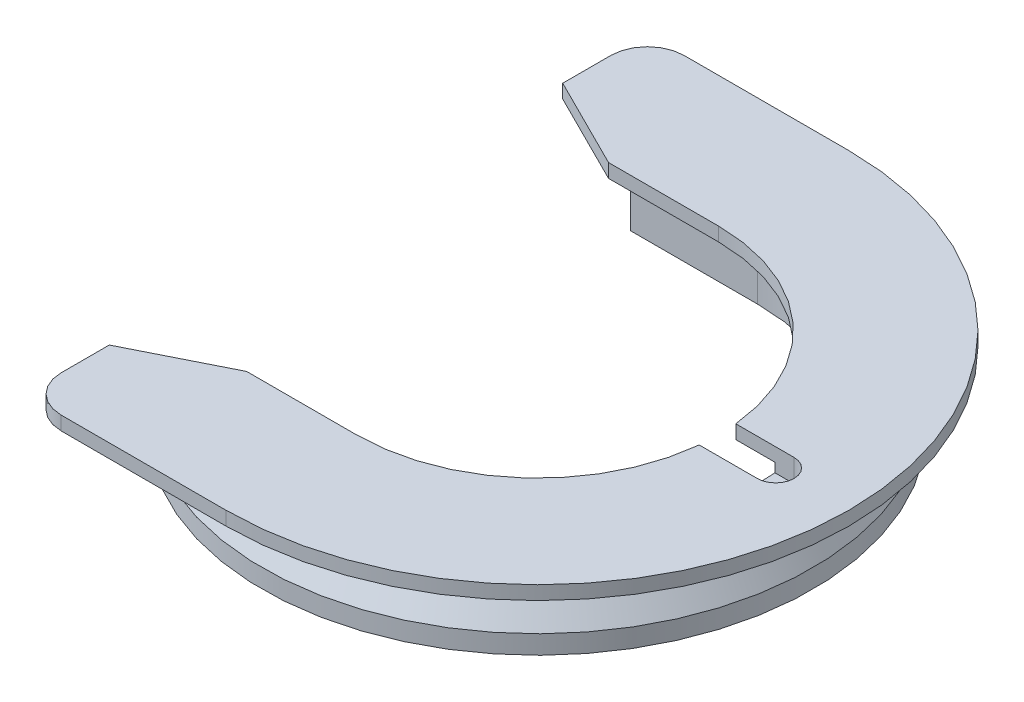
SolidWorks part; units mm, degrees
ref_plane "Front Plane" through (0, 0, 0) normal (0, 0, 1) x (1, 0, 0)
ref_plane "Top Plane" through (0, 0, 0) normal (0, 1, 0) x (1, 0, 0)
ref_plane "Right Plane" through (0, 0, 0) normal (1, 0, 0) x (0, 0, -1)
sketch "Sketch1" plane through (0, 0, 0) normal (0, 1, 0) x (1, 0, 0)
  line L0 (0, 34) -> (-22, 34)
  line L1 (-22, 34) -> (-22, -34)
  line L2 (-22, -34) -> (0, -34)
  line L3 (0, 34) -> (0, 0) construction
  line L4 (0, 0) -> (0, -34) construction
  arc A0 (0, 34) -> (0, -34) centre (0, 0) cw
  dimension "D1" = 34
  dimension "D2" = 22
extrude "Boss-Extrude1" add sketch "Sketch1" along normal blind 1.5
sketch "Sketch2" plane through (0, 1.5, 0) normal (0, 1, 0) x (1, 0, 0)
  line L0 (0, 19.75) -> (-22, 19.75)
  line L1 (-22, 34) -> (-22, -34) construction
  line L2 (-22, 19.75) -> (-22, -19.75)
  line L3 (-22, -19.75) -> (0, -19.75)
  line L4 (0, 19.75) -> (0, 0) construction
  line L5 (0, 0) -> (0, -19.75) construction
  arc A0 (0, 19.75) -> (0, -19.75) centre (0, 0) cw
  dimension "D1" = 19.75
extrude "Cut-Extrude1" cut sketch "Sketch2" against normal through all
sketch "Sketch3" plane through (0, 0, 0) normal (0, -1, 0) x (-1, 0, 0)
  line L0 (0, -24) -> (0, 0) construction
  line L1 (0, 0) -> (0, 24) construction
  line L2 (0, -24) -> (13.8564, -24)
  line L3 (0, 0) -> (10.3006, -28.3005) construction
  line L4 (13.8564, -24) -> (15, -25.9808)
  line L5 (0, 0) -> (-37.1009, 0) construction
  line L6 (0, 24) -> (13.8564, 24)
  line L7 (13.8564, 24) -> (15, 25.9808)
  line L8 (0, 0) -> (11.6618, 32.0405) construction
  arc A0 (0, -24) -> (0, 24) centre (0, 0) cw
  arc A2 (15, -25.9808) -> (15, 25.9808) centre (0, 0) cw
  dimension "D1" = 24
  dimension "D2" = 30
  dimension "D3" = 110
  dimension "D4" = 120
  dimension "D5" = 120
  dimension "D6" = 110
extrude "Boss-Extrude2" add sketch "Sketch3" along normal blind 8
sketch "Sketch7" plane through (0, 0, 0) normal (-0.866, 0, -0.5) x (-0.5, 0, 0.866)
  line L0 (30, -2.5) -> (28, -2.5)
  line L1 (30, -8) -> (30, 0) construction
  line L2 (28, -2.5) -> (30, -5.9641)
  line L3 (30, -5.9641) -> (30, -2.5)
  line L4 (30, 0) -> (27.7128, 0) construction
  dimension "D1" = 30
  dimension "D2" = 2
  dimension "D3" = 2.5
revolve "Cut-Revolve1" cut sketch "Sketch7" about axis through (0, -8, 0) along (0, 1, 0)
fillet "Fillet2" [suppressed] radius 10
fillet "Fillet3" [suppressed] radius 5
hole_wizard "M3x0.5 Tapped Hole1" positions "Sketch10" profile "Sketch9" tap size "M3x0.5" standard "ANSI Metric"
sketch "Sketch10" plane through (0, 0, 0) normal (0, 0, 1) x (1, 0, 0)
  line L0 (0, -8) -> (0, 0) construction
  line L1 (-15, 0) -> (30, 0) construction
  point P0 (-4, -3)
  dimension "D1" = 4
  dimension "D2" = 3
sketch "Sketch9" plane through (-4, -3, 0) normal (1, 0, 0) x (0, 1, 0)
  line L0 (0, 0) -> (0, 34)
  line L1 (0, 34) -> (1.25, 34)
  line L2 (1.25, 34) -> (1.25, 0)
  line L5 (1.25, 0) -> (0, 0)
  line L11 (0, -6.35) -> (0, 107.95) construction
  dimension "Thru Tap Drill Dia." = 2.5
  dimension "Thru Tap Drill Depth" = 34
chamfer "Chamfer2" distance 5 distance2 10 1 edges at (-22, 0.75, 19.75)
chamfer "Chamfer3" distance 10 distance2 5 1 edges at (-22, 0.75, -19.75)
fillet "Fillet4" [suppressed] radius 2
fillet "Fillet5" radius 4 2 edges at (-22, 0.75, -34) (-22, 0.75, 34)
sketch "Sketch11" plane through (0, 1.5, 0) normal (0, 1, 0) x (1, 0, 0)
  line L0 (18, 0) -> (26, 0) construction
  line L1 (18, 2) -> (26, 2)
  line L2 (18, -2) -> (26, -2)
  arc A0 (18, 2) -> (18, -2) centre (18, 0) ccw
  arc A1 (26, -2) -> (26, 2) centre (26, 0) ccw
  point P3 (22, 0)
  dimension "D1" = 2
  dimension "D2" = 8
  dimension "D3" = 18
extrude "Cut-Extrude2" cut sketch "Sketch11" against normal blind 2.5
